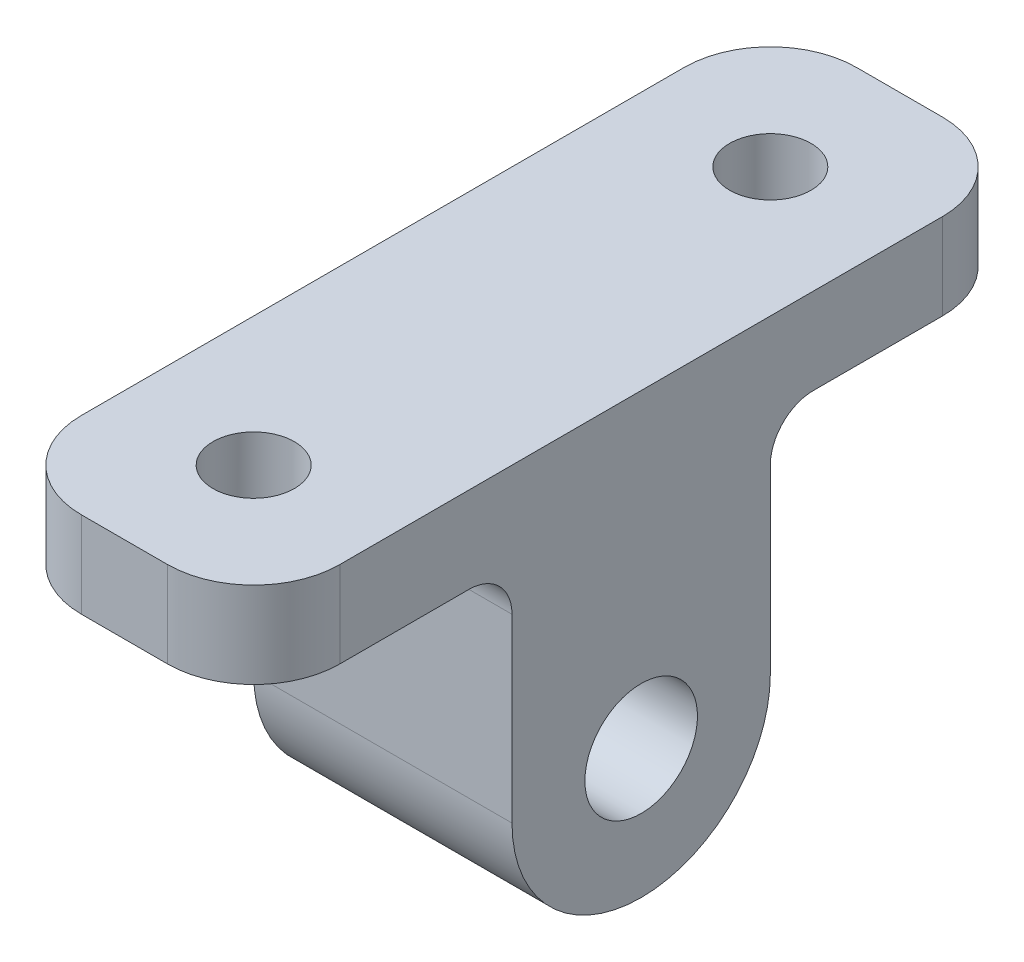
SolidWorks part; units mm, degrees
ref_plane "Front Plane" through (0, 0, 0) normal (0, 0, 1) x (1, 0, 0)
ref_plane "Top Plane" through (0, 0, 0) normal (0, 1, 0) x (1, 0, 0)
ref_plane "Right Plane" through (0, 0, 0) normal (1, 0, 0) x (0, 0, -1)
sketch "Sketch2" plane through (0, 0, 0) normal (1, 0, 0) x (0, 0, -1)
  line L0 (-4.7625, 0) -> (-4.7625, 8.255)
  line L1 (-4.7625, 8.255) -> (-14.2875, 8.255)
  line L2 (-14.2875, 8.255) -> (-14.2875, 11.43)
  line L3 (-14.2875, 11.43) -> (14.2875, 11.43)
  line L4 (0, 2.075) -> (0, 0)
  line L5 (4.7625, 0) -> (4.7625, 8.255)
  line L6 (4.7625, 8.255) -> (14.2875, 8.255)
  line L7 (14.2875, 8.255) -> (14.2875, 11.43)
  circle A0 centre (0, 0) radius 2.075
  arc A1 (-4.7625, 0) -> (4.7625, 0) centre (0, 0) ccw
  dimension "D1" = 4.15
  dimension "D2" = 9.525
  dimension "D3" = 8.255
  dimension "D4" = 9.525
  dimension "D5" = 3.175
  dimension "D6" = 28.575
extrude "Boss-Extrude1" add sketch "Sketch2" along normal blind 9.525 contours L0 A1 L5 L6 L7 L3 L2 L1 A0
sketch "Sketch3" plane through (0, 11.43, 0) normal (0, 1, 0) x (1, 0, 0)
  line L3 (9.525, -14.2875) -> (9.525, 14.2875) construction
  line L4 (9.525, -14.2875) -> (0, -14.2875) construction
  line L6 (9.525, 14.2875) -> (0, 14.2875) construction
  point P0 (4.7625, 9.525)
  point P2 (4.7625, -9.525)
  dimension "D1" = 4.7625
  dimension "D2" = 4.7625
  dimension "D3" = 4.7625
  dimension "D4" = 4.7625
  dimension "D5" = 19.05
hole_wizard "Ø3.0mm Dowel Hole1" positions "Sketch3" profile "Sketch4" hole size "Ø3.0" standard "ANSI Metric"
sketch "Sketch4" plane through (4.7625, 11.43, -9.525) normal (1, 0, 0) x (0, 0, 1)
  line L0 (0, 0) -> (0, 16.1925)
  line L1 (0, 16.1925) -> (1.5, 16.1925)
  line L2 (1.5, 16.1925) -> (1.5, 0)
  line L5 (1.5, 0) -> (0, 0)
  line L11 (0, -6.35) -> (0, 107.95) construction
  dimension "Thru Hole Dia." = 3
  dimension "Thru Hole Depth" = 16.1925
fillet "Fillet1" radius 3.175 4 edges at (9.525, 9.8425, 14.2875) (0, 9.8425, 14.2875) (9.525, 9.8425, -14.2875) (0, 9.8425, -14.2875)
fillet "Fillet2" radius 1.5875 2 edges at (4.7625, 8.255, 4.7625) (4.7625, 8.255, -4.7625)
